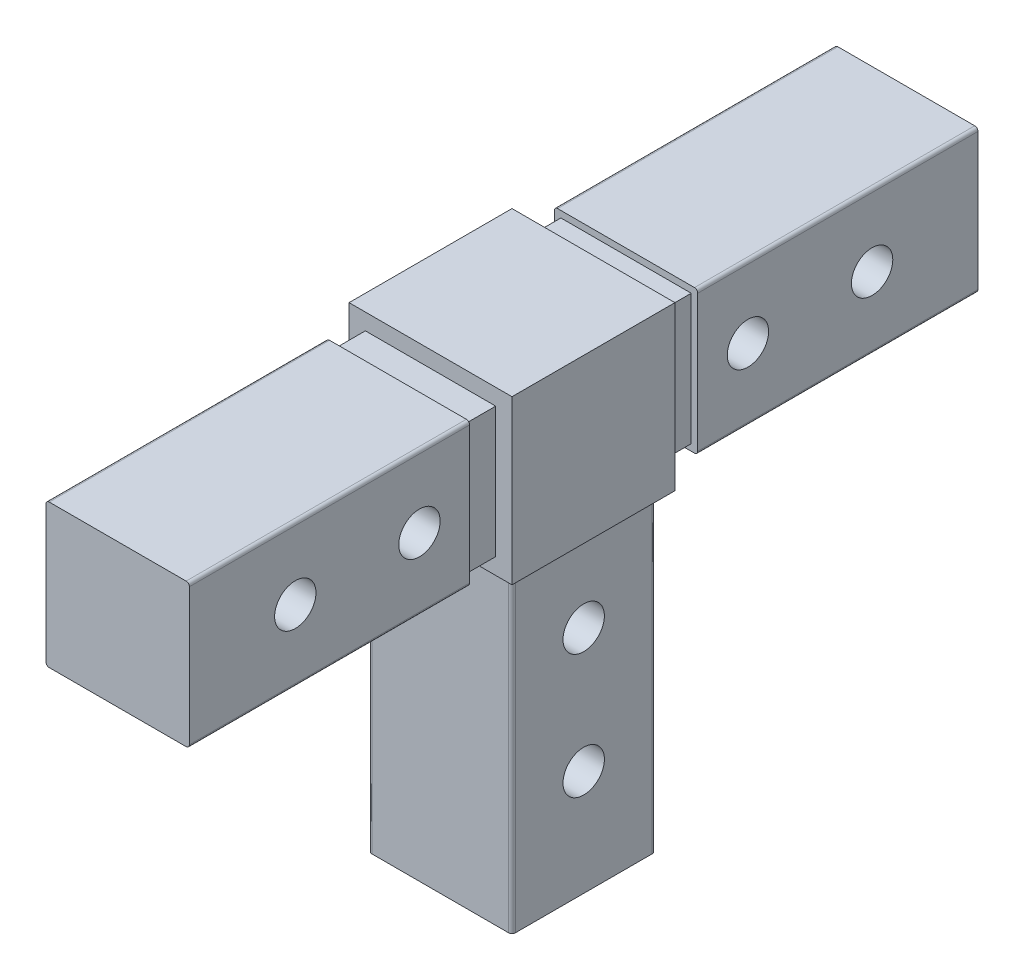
SolidWorks part; units mm, degrees
ref_plane "Front Plane" through (0, 0, 0) normal (0, 0, 1) x (1, 0, 0)
ref_plane "Top Plane" through (0, 0, 0) normal (0, 1, 0) x (1, 0, 0)
ref_plane "Right Plane" through (0, 0, 0) normal (1, 0, 0) x (0, 0, -1)
imported_body "Imported2"
imported_body "Imported3"
sketch "Sketch1" plane through (0, 0, 12.5) normal (0, 0, 1) x (1, 0, 0)
  line L0 (-10, 10) -> (10, 10)
  line L1 (10, 10) -> (10, -10)
  line L2 (10, -10) -> (-10, -10)
  line L3 (-10, -10) -> (-10, 10)
extrude "Boss-Extrude1" add sketch "Sketch1" along normal blind 5
ref_plane "Plane1" through (0, 0, 17.5) normal (0, 0, -1) x (-1, 0, 0)
sketch "Sketch2" plane through (0, 0, 17.5) normal (0, 0, -1) x (-1, 0, 0)
  line L0 (11, -11) -> (11, 11)
  line L1 (11, 11) -> (-11, 11)
  line L2 (-11, 11) -> (-11, -11)
  line L3 (-11, -11) -> (11, -11)
extrude "Boss-Extrude2" add sketch "Sketch2" against normal blind 43
sketch "Sketch3" plane through (0, 10, 0) normal (0, 1, 0) x (-1, 0, 0)
  line L0 (12.5, -12.5) -> (-12.5, -12.5)
  line L1 (-12.5, -12.5) -> (-12.5, 12.5)
  line L2 (-12.5, 12.5) -> (12.5, 12.5)
  line L3 (12.5, 12.5) -> (12.5, -12.5)
extrude "Boss-Extrude3" add sketch "Sketch3" along normal blind 2.5
sketch "Sketch4" plane through (0, -10, 0) normal (0, -1, 0) x (1, 0, 0)
  line L0 (12.5, -12.5) -> (-12.5, -12.5)
  line L1 (-12.5, -12.5) -> (-12.5, 12.5)
  line L2 (-12.5, 12.5) -> (12.5, 12.5)
  line L3 (12.5, 12.5) -> (12.5, -12.5)
extrude "Boss-Extrude4" add sketch "Sketch4" along normal blind 2.5
sketch "Sketch5" plane through (0, 0, -12.5) normal (0, 0, -1) x (-1, 0, 0)
  line L0 (10, -11) -> (-11, -11)
  line L1 (-11, -11) -> (-11, 11)
  line L2 (-11, 11) -> (10, 11)
  line L3 (10, 11) -> (10, -11)
extrude "Boss-Extrude5" add sketch "Sketch5" along normal blind 48
ref_plane "Plane2" through (0, 0, -12.5) normal (0, 0, 1) x (1, 0, 0)
sketch "Sketch6" plane through (0, 0, -12.5) normal (0, 0, 1) x (1, 0, 0)
  line L0 (-10, -10) -> (-10, -11)
  line L1 (-10, -11) -> (11, -11)
  line L2 (11, -11) -> (11, 11)
  line L3 (11, 11) -> (-10, 11)
  line L4 (-10, 11) -> (-10, 10)
  line L5 (-10, 10) -> (10, 10)
  line L6 (10, 10) -> (10, -10)
  line L7 (10, -10) -> (-10, -10)
extrude "Cut-Extrude1" cut sketch "Sketch6" against normal blind 5
sketch "Sketch7" plane through (-10, 0, 0) normal (-1, 0, 0) x (0, 0, 1)
  line L0 (-17.5, 11) -> (-17.5, -11)
  line L1 (-17.5, -11) -> (-60.5, -11)
  line L2 (-60.5, -11) -> (-60.5, 11)
  line L3 (-60.5, 11) -> (-17.5, 11)
extrude "Boss-Extrude6" add sketch "Sketch7" along normal blind 1
sketch "Sketch8" plane through (0, -12.5, 0) normal (0, -1, 0) x (1, 0, 0)
  line L0 (-11, 11) -> (11, 11)
  line L1 (11, 11) -> (11, -11)
  line L2 (11, -11) -> (-11, -11)
  line L3 (-11, -11) -> (-11, 11)
extrude "Boss-Extrude7" add sketch "Sketch8" along normal blind 48
fillet "Fillet1" radius 0.5 12 edges at (-11, -11, -39) (-11, -36.5, -11) (11, -36.5, 11) (11, -11, 39) (11, -11, -39) (11, 11, 39) (-11, -36.5, 11) (-11, 11, 39) (11, -36.5, -11) (-11, 11, -39) (-11, -11, 39) (11, 11, -39)
sketch "Sketch10" plane through (11, 0, 0) normal (1, 0, 0) x (0, 0, -1)
  line L0 (0, -12.5) -> (0, -60.5) construction
  line L1 (10.5, -12.5) -> (-10.5, -12.5) construction
  line L2 (10.5, -60.5) -> (-10.5, -60.5) construction
  line L3 (12.5, -12.5) -> (-12.5, -12.5) construction
  line L4 (-60.5, 0) -> (-17.5, 0) construction
  line L5 (-60.5, 10.5) -> (-60.5, -10.5) construction
  line L6 (-17.5, -10) -> (-17.5, 10) construction
  line L7 (17.5, 0) -> (60.5, 0) construction
  line L8 (17.5, -10.5) -> (17.5, 10.5) construction
  line L9 (60.5, 10.5) -> (60.5, -10.5) construction
  line L10 (-12.5, -10) -> (-12.5, 10) construction
  line L11 (-12.5, -12.5) -> (-12.5, 12.5) construction
  line L12 (12.5, 13.75) -> (12.5, -13.75) construction
  circle A0 centre (0, -25.2) radius 3.175
  circle A1 centre (0, -44.25) radius 3.175
  circle A2 centre (-25.2, 0) radius 3.175
  circle A3 centre (-44.25, 0) radius 3.175
  circle A4 centre (25.2, 0) radius 3.175
  circle A5 centre (44.25, 0) radius 3.175
  dimension "D3" = 6.35
  dimension "D4" = 6.35
  dimension "D9" = 6.35
  dimension "D10" = 6.35
  dimension "D11" = 6.35
  dimension "D12" = 6.35
  dimension "D1" = 12.7
  dimension "D2" = 31.75
  dimension "D5" = 12.7
  dimension "D6" = 31.75
  dimension "D7" = 12.7
  dimension "D8" = 31.75
extrude "Cut-Extrude3" cut sketch "Sketch10" against normal up to surface (22 mm away)
